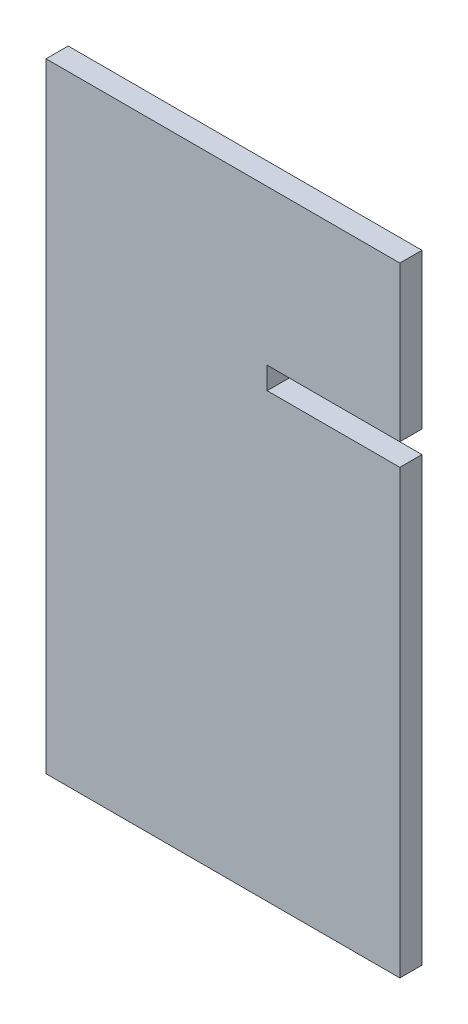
SolidWorks part; units mm, degrees
other "Objet de détail3"
ref_plane "Plan de face" through (0, 0, 0) normal (0, 0, 1) x (1, 0, 0)
ref_plane "Plan de dessus" through (0, 0, 0) normal (0, 1, 0) x (1, 0, 0)
ref_plane "Plan de droite" through (0, 0, 0) normal (1, 0, 0) x (0, 0, -1)
sketch "Esquisse1" plane through (0, 0, 0) normal (0, 0, 1) x (1, 0, 0)
  line L0 (54.5165, 35.9833) -> (54.5165, 0.9833)
  line L1 (-25.4835, 35.9833) -> (54.5165, 35.9833)
  line L2 (-25.4835, 35.9833) -> (-25.4835, -104.0167)
  line L3 (-25.4835, -104.0167) -> (54.5165, -104.0167)
  line L4 (54.5165, -4.0167) -> (54.5165, -104.0167)
  line L5 (24.5165, 0.9833) -> (54.5165, 0.9833)
  line L6 (24.5165, 0.9833) -> (24.5165, -4.0167)
  line L7 (24.5165, -4.0167) -> (54.5165, -4.0167)
  dimension "D1" = 80
  dimension "D2" = 140
  dimension "D3" = 5
  dimension "D4" = 35
  dimension "D5" = 30
extrude "Boss.-Extru.1" add sketch "Esquisse1" along normal blind 5
